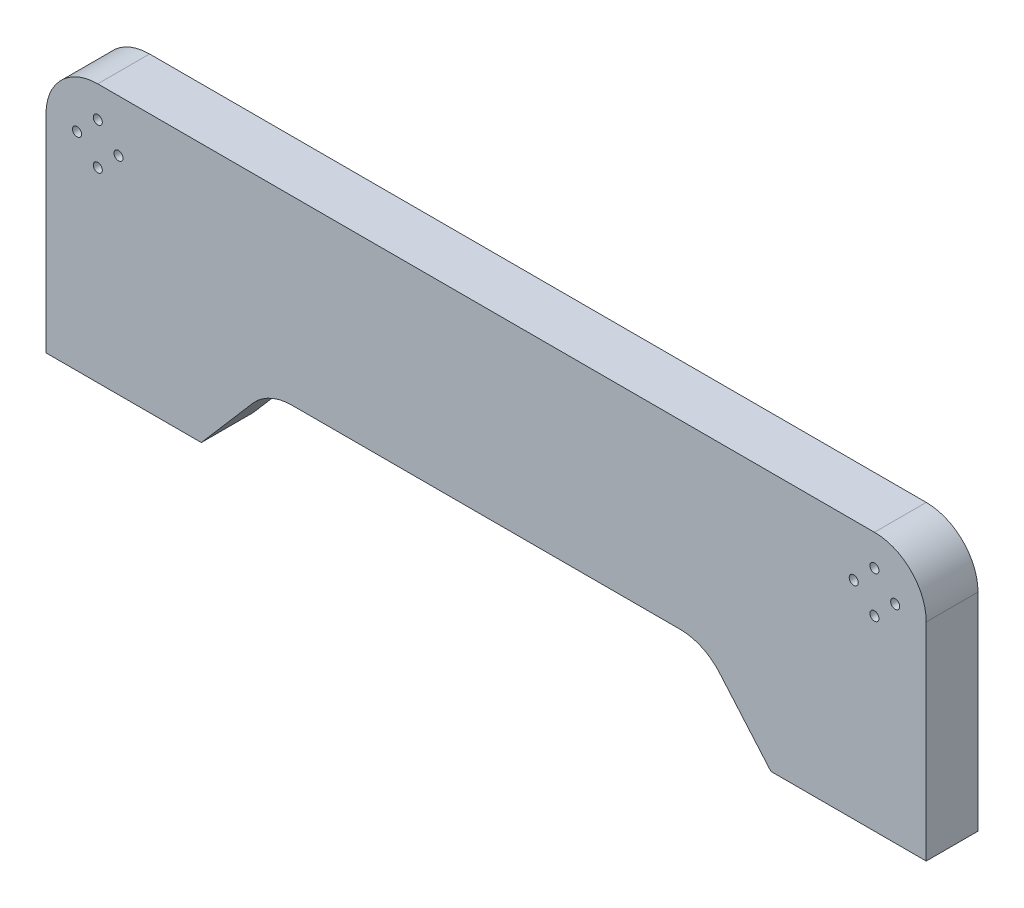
SolidWorks part; units mm, degrees
ref_plane "Alzado" through (0, 0, 0) normal (0, 0, 1) x (1, 0, 0)
ref_plane "Planta" through (0, 0, 0) normal (0, 1, 0) x (1, 0, 0)
ref_plane "Vista lateral" through (0, 0, 0) normal (1, 0, 0) x (0, 0, -1)
sketch "Croquis1" plane through (0, 0, 0) normal (0, 0, 1) x (1, 0, 0)
  line L0 (0, 0) -> (60, 0)
  line L1 (60, 0) -> (79.8432, 23.0488)
  line L2 (95, 30) -> (245, 30)
  line L3 (260.1568, 23.0488) -> (280, 0)
  line L4 (280, 0) -> (340, 0)
  line L5 (340, 0) -> (340, 80)
  line L6 (320, 100) -> (20, 100)
  line L7 (0, 80) -> (0, 0)
  line L8 (170, 144.4779) -> (170, -9.554) construction
  arc A0 (20, 100) -> (0, 80) centre (20, 80) ccw
  arc A1 (340, 80) -> (320, 100) centre (320, 80) ccw
  arc A2 (245, 30) -> (260.1568, 23.0488) centre (245, 10) cw
  arc A3 (79.8432, 23.0488) -> (95, 30) centre (95, 10) cw
  circle A4 centre (12, 80) radius 1.75
  circle A8 centre (20, 80) radius 8 construction
  circle A9 centre (20, 88) radius 1.75
  circle A10 centre (28, 80) radius 1.75
  circle A11 centre (20, 72) radius 1.75
  circle A12 centre (320, 88) radius 1.75
  circle A13 centre (328, 80) radius 1.75
  circle A14 centre (320, 72) radius 1.75
  circle A15 centre (312, 80) radius 1.75
  point P20 (0, 0)
  point P27 (0, 0)
  point P35 (20, 80)
  dimension "D1" = 20
  dimension "D2" = 20
  dimension "D3" = 20
  dimension "D11" = 3.5
  dimension "D12" = 16
  dimension "D4" = 300
  dimension "D5" = 60
  dimension "D6" = 60
  dimension "D7" = 100
  dimension "D8" = 70
  dimension "D9" = 150
  dimension "D10" = 35
  dimension "D13" = 4
  dimension "D14" = 16
  dimension "D15" = 150
  dimension "D16" = 8
extrude "Saliente-Extruir1" add sketch "Croquis1" along normal blind 20
